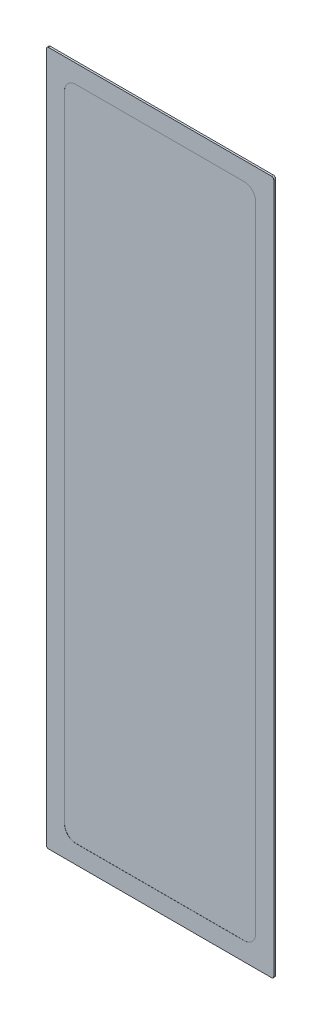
SolidWorks part; units mm, degrees
other "<Door Glass>-<Cut-Extrude1>"
ref_plane "Front Plane" through (0, 0, 0) normal (0, 0, 1) x (1, 0, 0)
ref_plane "Top Plane" through (0, 0, 0) normal (0, 1, 0) x (1, 0, 0)
ref_plane "Right Plane" through (0, 0, 0) normal (1, 0, 0) x (0, 0, -1)
mirrored part "Door Glass_Mirrored"
